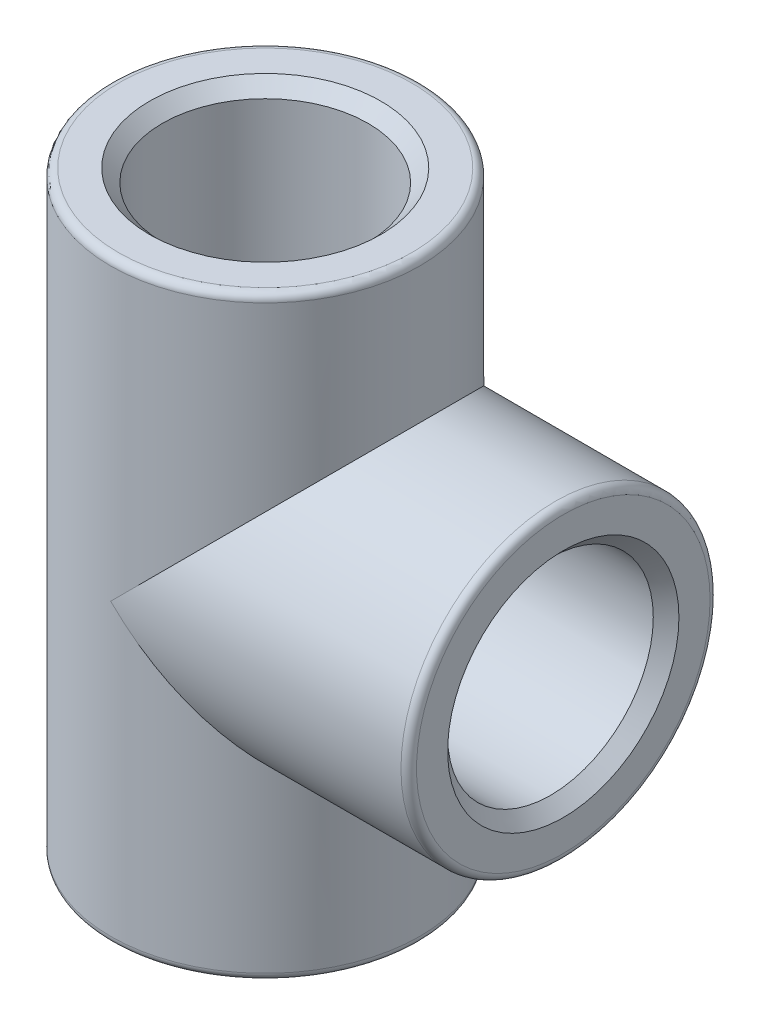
SolidWorks part; units mm, degrees
ref_plane "Front" through (0, 0, 0) normal (0, 0, 1) x (1, 0, 0)
ref_plane "Top" through (0, 0, 0) normal (0, 1, 0) x (1, 0, 0)
ref_plane "Right" through (0, 0, 0) normal (1, 0, 0) x (0, 0, -1)
ref_plane "Plane1" through (0, 0, 0) normal (0, 0, -1) x (-1, 0, 0)
sketch "Sketch1" plane through (0, 0, 0) normal (0, 0, -1) x (-1, 0, 0)
  line L0 (-14, 0) -> (0, 0)
  line L1 (0, 0) -> (0, 54)
  line L2 (0, 54) -> (-14, 54)
  line L3 (-14, 54) -> (-14, 0)
  line L4 (0, 0) -> (0, 54) construction
revolve "Revolve1" add sketch "Sketch1" angle 360 about L4
ref_plane "Plane2" through (0, 27, 0) normal (0, 1, 0) x (1, 0, 0)
sketch "Sketch2" plane through (0, 27, 0) normal (0, 1, 0) x (1, 0, 0)
  line L0 (27, 0) -> (27, 14)
  line L1 (27, 14) -> (0, 14)
  line L2 (0, 14) -> (0, 0)
  line L3 (0, 0) -> (27, 0)
  line L4 (0, 0) -> (27, 0) construction
revolve "Revolve2" add sketch "Sketch2" angle 360 about L4
sketch "Sketch3" plane through (0, 0, 0) normal (0, 0, -1) x (-1, 0, 0)
  line L0 (-9.3155, 0) -> (0, 0)
  line L1 (0, 0) -> (0, 54)
  line L2 (0, 54) -> (-9.3155, 54)
  line L3 (-9.3155, 54) -> (-9.3155, 38)
  line L4 (-9.3155, 38) -> (-8.3839, 38)
  line L5 (-8.3839, 38) -> (-8.3839, 16)
  line L6 (-8.3839, 16) -> (-9.3155, 16)
  line L7 (-9.3155, 16) -> (-9.3155, 0)
  line L8 (0, 0) -> (0, 54) construction
revolve "Cut-Revolve1" cut sketch "Sketch3" angle 360 about L8
hole_wizard "CBORE for M14 Hex Head Bolt1" positions "Sketch5" profile "Sketch4" counterbore size "M14" standard "ANSI Metric"
sketch "Sketch5" plane through (27, 0, 0) normal (1, 0, 0) x (0, 0, -1)
  point P0 (0, 27)
sketch "Sketch4" plane through (27, 27, 0) normal (0, 1, 0) x (0, 0, -1)
  line L0 (0, 0) -> (0, 18.6161)
  line L1 (0, 18.6161) -> (8.3839, 18.6161)
  line L3 (8.3839, 18.6161) -> (8.384, 16)
  line L4 (8.384, 16) -> (9.3155, 16)
  line L5 (9.3155, 16) -> (9.3155, 0)
  line L7 (9.3155, 0) -> (0, 0)
  line L11 (0, -6.35) -> (0, 107.95) construction
  dimension "Thru Hole Dia." = 16.7679
  dimension "Thru Hole Depth" = 18.6161
  dimension "C'Bore Dia." = 18.631
  dimension "C'Bore Depth" = 16
chamfer "Chamfer1" distance 1.162 angle 45 3 edges at (0, 54, 9.3155) (0, 0, 9.3155) (27, 27, -9.3155)
fillet "Fillet1" radius 0.7045 3 edges at (0, 0, 14) (0, 54, 14) (27, 27, -14)
